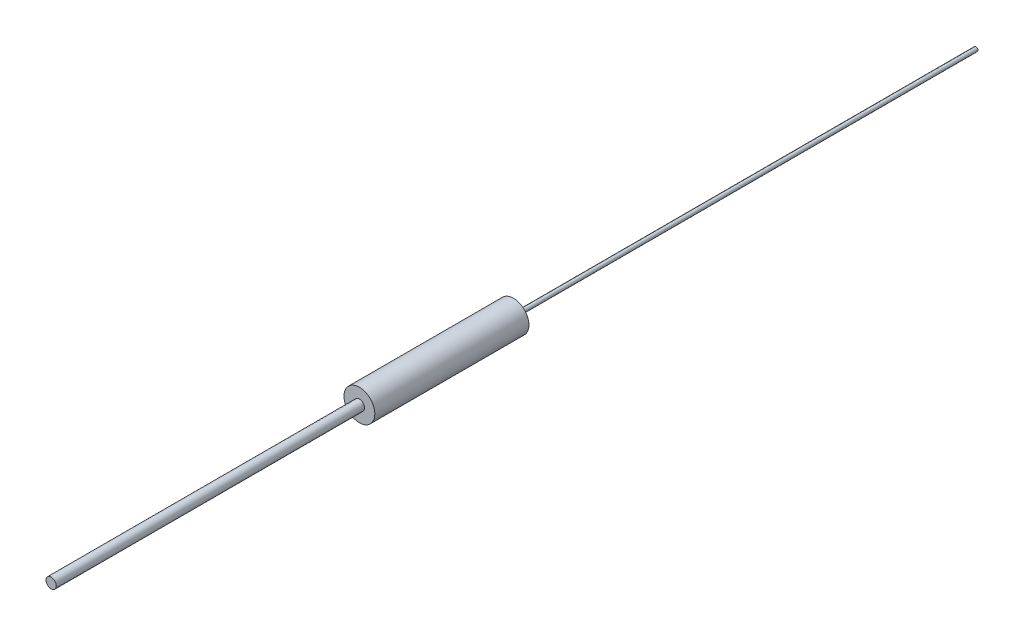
SolidWorks part; units mm, degrees
ref_plane "前视基准面" through (0, 0, 0) normal (0, 0, 1) x (1, 0, 0)
ref_plane "上视基准面" through (0, 0, 0) normal (0, 1, 0) x (1, 0, 0)
ref_plane "右视基准面" through (0, 0, 0) normal (1, 0, 0) x (0, 0, -1)
sketch "草图1" plane through (0, 0, 0) normal (0, 0, 1) x (1, 0, 0)
  circle A0 centre (0, 0) radius 1.5
  dimension "D1" = 3
extrude "凸台-拉伸1" add sketch "草图1" along normal blind 15
sketch "草图2" plane through (0, 0, 0) normal (0, 0, -1) x (-1, 0, 0)
  circle A0 centre (0, 0) radius 0.2
  dimension "D1" = 0.4
extrude "凸台-拉伸2" add sketch "草图2" along normal blind 45
sketch "草图3" plane through (0, 0, 15) normal (0, 0, 1) x (1, 0, 0)
  circle A0 centre (0, 0) radius 0.5
  dimension "D1" = 1
extrude "凸台-拉伸3" add sketch "草图3" along normal blind 30
sketch "草图4" plane through (0, 0, -45) normal (0, 0, -1) x (-1, 0, 0)
  circle A0 centre (0, 0) radius 0.1375
  circle A1 centre (0, 0) radius 0.1325
  dimension "D1" = 0.275
  dimension "D2" = 0.265
extrude "切除-拉伸1" cut sketch "草图4" against normal blind 0.1
